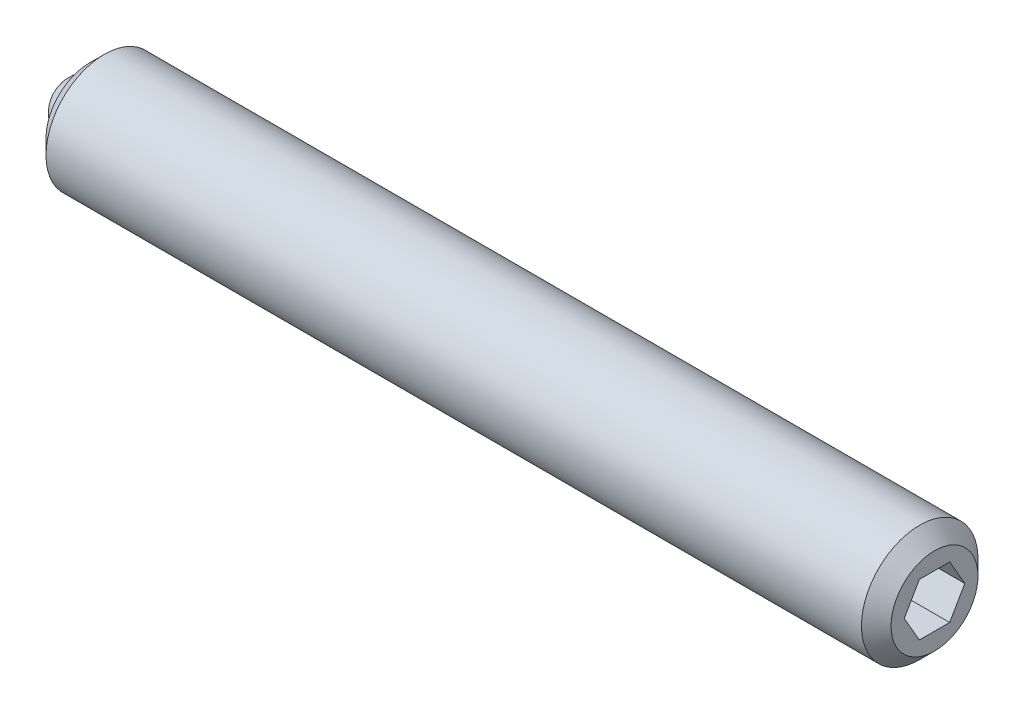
SolidWorks part; units mm, degrees
ref_plane "Front Plane" through (0, 0, 0) normal (0, 0, 1) x (1, 0, 0)
ref_plane "Top Plane" through (0, 0, 0) normal (0, 1, 0) x (1, 0, 0)
ref_plane "Right Plane" through (0, 0, 0) normal (1, 0, 0) x (0, 0, -1)
sketch "Sketch2" plane through (0, 0, 0) normal (1, 0, 0) x (0, 0, -1)
  circle A0 centre (0, 0) radius 1
  dimension "D1" = 2
extrude "Boss-Extrude1" add sketch "Sketch2" along normal blind 14.5
sketch "Sketch3" plane through (0, 0, 0) normal (-1, 0, 0) x (0, 0, 1)
  circle A0 centre (0, 0) radius 0.5
  dimension "D1" = 1
chamfer "Chamfer1" distance 0.254 angle 45 1 edges at (0, 0, -1)
chamfer "Chamfer2" distance 0.254 angle 45 1 edges at (14.5, 0, -1)
sketch "Sketch4" plane through (14.5, 0, 0) normal (1, 0, 0) x (0, 0, -1)
  line L1 (0.5196, 0) -> (0.2598, 0.45)
  line L2 (0.2598, 0.45) -> (-0.2598, 0.45)
  line L3 (-0.2598, 0.45) -> (-0.5196, 0)
  line L4 (-0.5196, 0) -> (-0.2598, -0.45)
  line L5 (-0.2598, -0.45) -> (0.2598, -0.45)
  line L6 (0.2598, -0.45) -> (0.5196, 0)
  circle A0 centre (0, 0) radius 0.45 construction
  dimension "D1" = 0.9
extrude "Cut-Extrude2" cut sketch "Sketch4" against normal blind 2
extrude "Cut-Extrude3" cut sketch "Sketch3" against normal blind 0.5
sketch "Sketch5" plane through (0, 0, 0) normal (-1, 0, 0) x (0, 0, 1)
  line L0 (0, 0) -> (0, -0.5)
  line L1 (0, 0) -> (0, 0.5)
  arc A0 (0, 0.5) -> (0, -0.5) centre (0, 0) ccw
  dimension "D1" = 0.5
revolve "Revolve1" add sketch "Sketch5" angle 360 about L1
